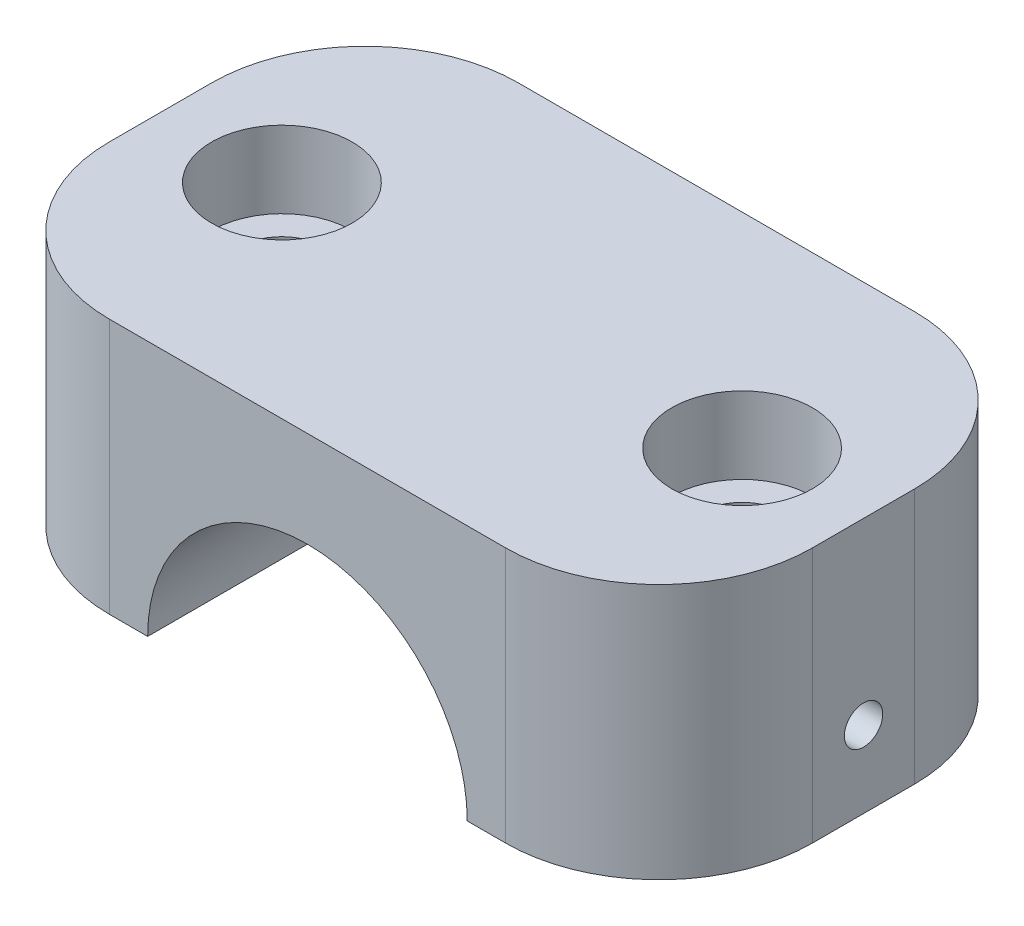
SolidWorks part; units mm, degrees
ref_plane "Front Plane" through (0, 0, 0) normal (0, 0, 1) x (1, 0, 0)
ref_plane "Top Plane" through (0, 0, 0) normal (0, 1, 0) x (1, 0, 0)
ref_plane "Right Plane" through (0, 0, 0) normal (1, 0, 0) x (0, 0, -1)
sketch "Sketch1" plane through (0, 0, 0) normal (0, 0, 1) x (1, 0, 0)
  line L1 (-27.5, 0) -> (27.5, 0)
  line L2 (-27.5, 0) -> (-27.5, 20)
  line L3 (-27.5, 20) -> (27.5, 20)
  line L4 (27.5, 0) -> (27.5, 20)
  dimension "D1" = 55
  dimension "D2" = 20
extrude "Extrude1" add sketch "Sketch1" along normal mid plane 32
sketch "Sketch2" plane through (0, 0, 16) normal (0, 0, 1) x (1, 0, 0)
  line L0 (-27.5, 0) -> (27.5, 0) construction
  arc A0 (12.5, 0) -> (-12.5, 0) centre (0, 0) ccw
  dimension "D1" = 12.5
extrude "Cut-Extrude1" cut sketch "Sketch2" against normal through all and the other way through all
fillet "Fillet1" radius 12 4 edges at (27.5, 10, 16) (-27.5, 10, 16) (-27.5, 10, -16) (27.5, 10, -16)
hole_wizard "CBORE for M6 SHCS1" positions "Sketch4" profile "Sketch3" counterbore size "M6" standard "Ansi Metric"
sketch "Sketch4" plane through (0, 20, 0) normal (0, 1, 0) x (-1, 0, 0)
  point P0 (18, 0)
  dimension "D1" = 18
sketch "Sketch3" plane through (-18, 20, 0) normal (1, 0, 0) x (0, 0, 1)
  line L0 (0, 0) -> (0, 20)
  line L1 (0, 20) -> (3.3, 20)
  line L3 (3.3, 20) -> (3.3, 6)
  line L4 (3.3, 6) -> (5.5, 6)
  line L5 (5.5, 6) -> (5.5, 0)
  line L7 (5.5, 0) -> (0, 0)
  line L11 (0, -6.35) -> (0, 107.95) construction
  dimension "Thru Hole Dia." = 6.6
  dimension "Thru Hole Depth" = 20
  dimension "C'Bore Dia." = 11
  dimension "C'Bore Depth" = 6
hole_wizard "M3.0 (3) Diameter Hole1" positions "Sketch6" profile "Sketch5" hole size "M3.0" standard "Ansi Metric"
sketch "Sketch6" plane through (27.5, 0, 0) normal (1, 0, 0) x (0, 0, -1)
  line L0 (-4, 0) -> (4, 0) construction
  point P0 (0, 6)
  point P4 (0, 0)
  dimension "D1" = 6
sketch "Sketch5" plane through (27.5, 6, 0) normal (0, 1, 0) x (0, 0, -1)
  line L0 (0, 0) -> (0, 4.9013)
  line L1 (0, 4.9013) -> (1.5, 4)
  line L2 (1.5, 4) -> (1.5, 0)
  line L5 (1.5, 0) -> (0, 0)
  line L10 (0, 4.9013) -> (-1.5, 4) construction
  line L11 (0, -6.35) -> (0, 107.95) construction
  dimension "Hole Dia." = 3
  dimension "Hole Depth" = 4
  dimension "Drill Angle" = 118
mirror "Mirror1" about plane through (0, 0, 0) normal (1, 0, 0) of "M3.0 (3) Diameter Hole1", "CBORE for M6 SHCS1"
